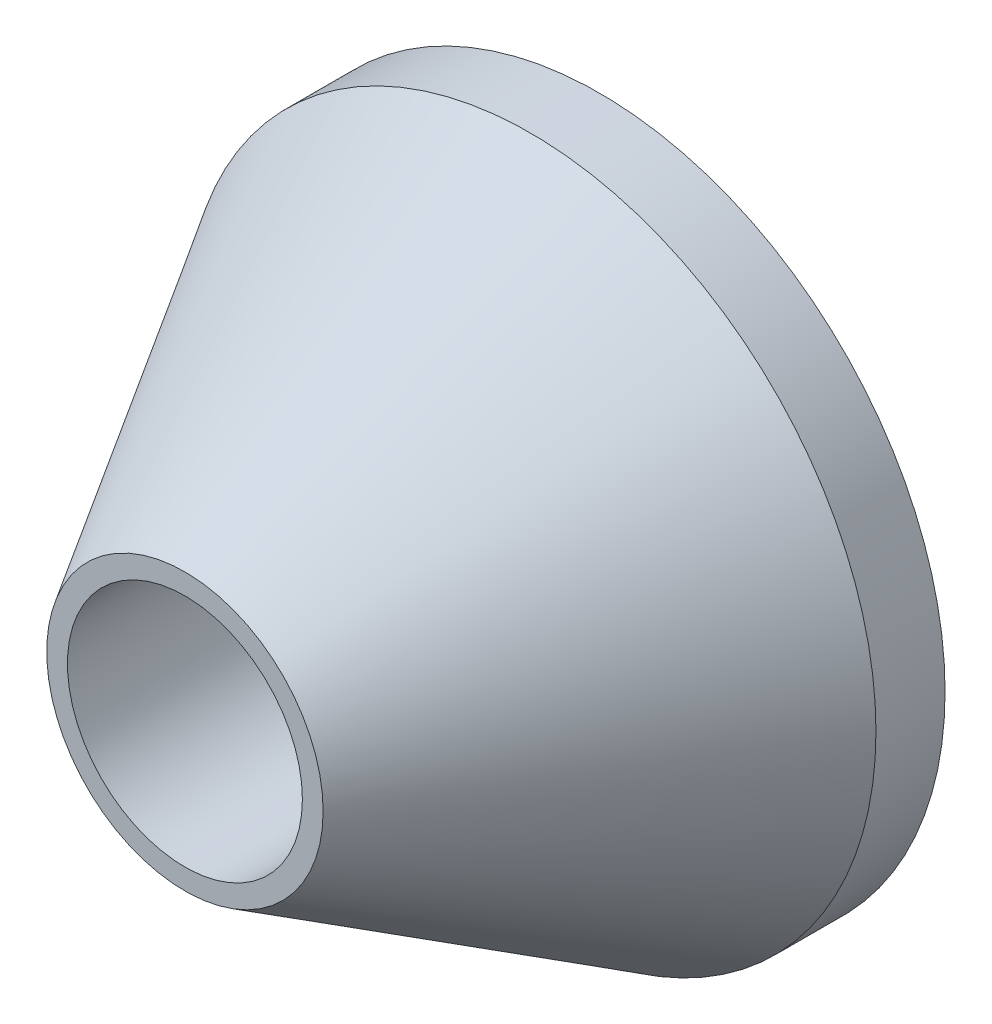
SolidWorks part; units mm, degrees
ref_plane "Plan1" through (0, 0, 0) normal (0, 0, 1) x (1, 0, 0)
ref_plane "Plan2" through (0, 0, 0) normal (0, 1, 0) x (1, 0, 0)
ref_plane "Plan3" through (0, 0, 0) normal (1, 0, 0) x (0, 0, -1)
sketch "Esquisse1" plane through (0, 0, 0) normal (0, 0, 1) x (1, 0, 0)
  circle A0 centre (0, 0) radius 2.5
  circle A1 centre (0, 0) radius 0.85
  dimension "D1" = 5
  dimension "D2" = 1.7
extrude "Extrusion1" add sketch "Esquisse1" along normal blind 3
chamfer "Chanfrein1" distance 2.5 distance2 1.5 1 edges at (2.5, 0, 3)
